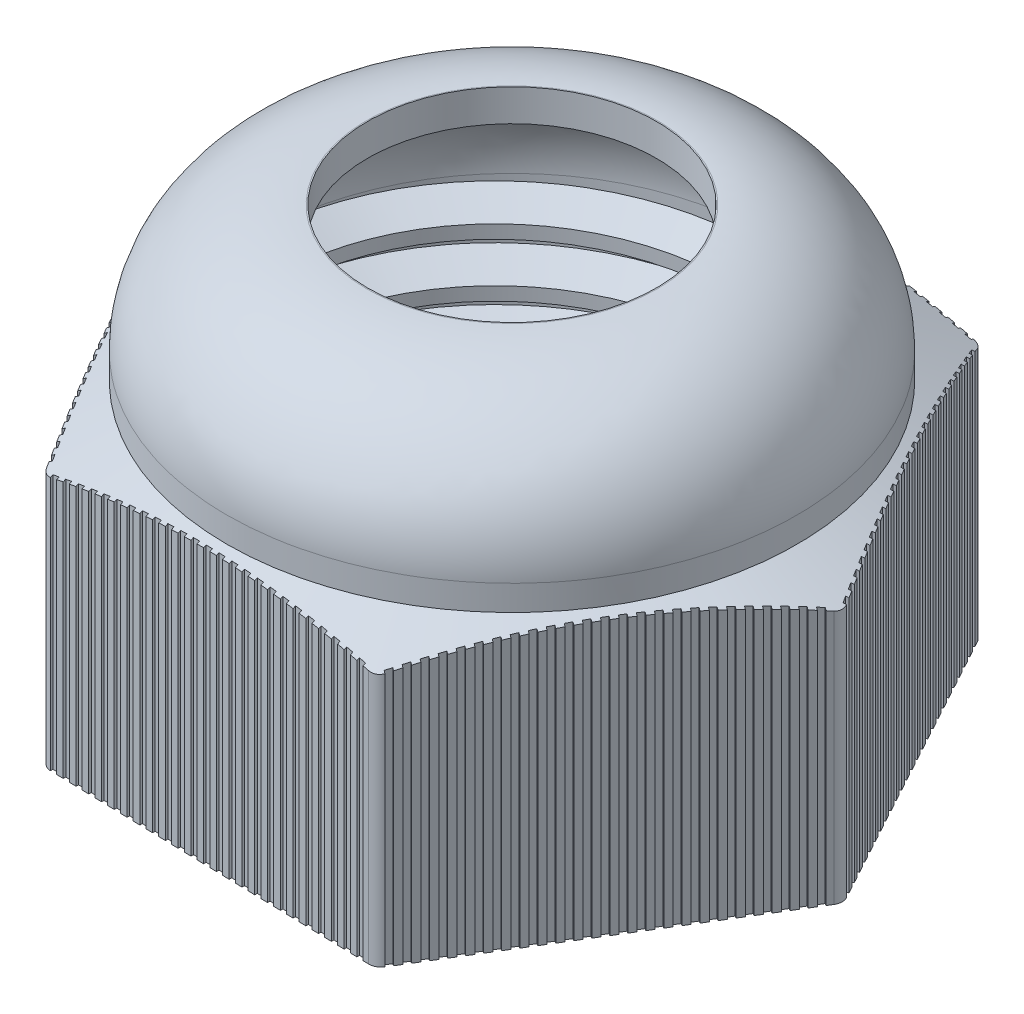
SolidWorks part; units mm, degrees
ref_plane "前视基准面" through (0, 0, 0) normal (0, 0, 1) x (1, 0, 0)
ref_plane "上视基准面" through (0, 0, 0) normal (0, 1, 0) x (1, 0, 0)
ref_plane "右视基准面" through (0, 0, 0) normal (1, 0, 0) x (0, 0, -1)
sketch "草图1" plane through (0, 0, 0) normal (0, 1, 0) x (1, 0, 0)
  line L1 (7.0192, 11.4758) -> (-6.4288, 11.8167)
  line L2 (-6.4288, 11.8167) -> (-13.4479, 0.3409)
  line L3 (-13.4479, 0.3409) -> (-7.0192, -11.4758)
  line L4 (-7.0192, -11.4758) -> (6.4288, -11.8167)
  line L5 (6.4288, -11.8167) -> (13.4479, -0.3409)
  line L6 (13.4479, -0.3409) -> (7.0192, 11.4758)
  circle A0 centre (0, 0) radius 11.65 construction
  dimension "D1" = 23.3
extrude "凸台-拉伸1" add sketch "草图1" along normal blind 11
sketch "草图2" plane through (0, 11, 0) normal (0, 1, 0) x (1, 0, 0)
  circle A0 centre (0, 0) radius 10
extrude "切除-拉伸1" cut sketch "草图2" against normal blind 11
thread "螺纹线1" pitch 2.1167 start angle 0, offset 0, length 9.2, pitch 2.1167, diameter 20
ref_plane "基准面1" through (-10, 11, 0) normal (0, 0, 1) x (-1, 0, 0)
sketch "螺纹线轮廓1" plane through (-10, 11, 0) normal (0, 0, 1) x (-1, 0, 0)
  line L0 (0, 0) -> (0, 2.1167) construction
  line L11 (0, 0) -> (0, 1.8521)
  line L12 (0, 1.8521) -> (-1.1457, 1.1906)
  line L13 (-1.1457, 1.1906) -> (-1.1457, 0.6615)
  line L15 (-1.1457, 0.6615) -> (0, 0)
  line L17 (-1.1457, 0.926) -> (0, 0.926) construction
  point P2 (0, 0)
  dimension "Pitch" = 2.1167
  dimension "Profile_Angle" = 60
  dimension "Profile_Land" = 0.5292
  dimension "Profile_Height" = 1.1457
sketch "草图6" plane through (-0.2952, 0, 11.6463) normal (-0.0253, 0, 0.9997) x (0.9997, 0, 0.0253)
  line L1 (-6.2084, 11) -> (-6.2084, 0)
  line L2 (-5.6907, 11) -> (-5.6907, 0)
  line L3 (-5.173, 11) -> (-5.173, 0)
  line L4 (-4.6553, 11) -> (-4.6553, 0)
  line L5 (-4.1375, 11) -> (-4.1375, 0)
  line L6 (-3.6198, 11) -> (-3.6198, 0)
  line L7 (-3.1021, 11) -> (-3.1021, 0)
  line L8 (-2.5844, 11) -> (-2.5844, 0)
  line L9 (-2.0667, 11) -> (-2.0667, 0)
  line L10 (-1.549, 11) -> (-1.549, 0)
  line L11 (-1.0312, 11) -> (-1.0312, 0)
  line L12 (-0.5135, 11) -> (-0.5135, 0)
  line L13 (0.0042, 11) -> (0.0042, 0)
  line L14 (0.5219, 11) -> (0.5219, 0)
  line L15 (1.0396, 11) -> (1.0396, 0)
  line L16 (1.5573, 11) -> (1.5573, 0)
  line L17 (2.0751, 11) -> (2.0751, 0)
  line L18 (2.5928, 11) -> (2.5928, 0)
  line L19 (3.1105, 11) -> (3.1105, 0)
  line L20 (3.6282, 11) -> (3.6282, 0)
  line L21 (4.1459, 11) -> (4.1459, 0)
  line L22 (4.6636, 11) -> (4.6636, 0)
  line L23 (5.1814, 11) -> (5.1814, 0)
  line L24 (5.6991, 11) -> (5.6991, 0)
  line L25 (6.2168, 11) -> (6.2168, 0)
extrude "切除-拉伸-薄壁2" cut sketch "草图6" against normal blind 0.1 thin
pattern_circular "阵列(圆周)1" count 6 over 360 about axis through (0, 0, 0) along (0, 1, 0) of "切除-拉伸-薄壁2"
fillet "圆角2" radius 0.5 1 edges at (-7.0192, 5.5, 11.4758)
fillet "圆角3" radius 0.5 1 edges at (6.4288, 5.5, 11.8167)
fillet "圆角4" radius 0.5 1 edges at (13.4479, 5.5, 0.3409)
fillet "圆角5" radius 0.5 1 edges at (7.0192, 5.5, -11.4758)
fillet "圆角6" radius 0.5 1 edges at (-6.6136, 5.5, -11.3229)
fillet "圆角7" radius 0.5 1 edges at (-6.4288, 5.5, -11.8167)
fillet "圆角8" radius 0.5 1 edges at (-13.4479, 5.5, -0.3409)
sketch "草图7" plane through (0, 11, 0) normal (0, 1, 0) x (1, 0, 0)
  circle A0 centre (0, 0) radius 11.25
extrude "切除-拉伸3" cut sketch "草图7" against normal blind 1 draft 65 flip side to cut
sketch "草图8" plane through (0, 11, 0) normal (0, 1, 0) x (1, 0, 0)
  circle A0 centre (0, 0) radius 11.25
extrude "凸台-拉伸2" add sketch "草图8" along normal blind 6
fillet "圆角9" radius 5 1 edges at (0, 17, 11.25)
sketch "草图9" plane through (0, 17, 0) normal (0, 1, 0) x (1, 0, 0)
  circle A0 centre (0, 0) radius 5.704
extrude "切除-拉伸4" cut sketch "草图9" against normal through all
sketch "草图12" plane through (0, 0, 0) normal (1, 0, 0) x (0, 0, -1)
  line L0 (0, 0) -> (0, 17) construction
  line L1 (5.704, 17) -> (-5.704, 17) construction
  line L2 (10, 11) -> (0, 11)
  line L3 (-10, 11) -> (10, 11) construction
  line L4 (-11.25, 11) -> (11.25, 11) construction
  line L5 (-5.704, 11) -> (5.704, 11) construction
  line L6 (0, 11) -> (0, 15.7367)
  line L7 (6.601, 15.7367) -> (0, 15.7367)
  arc A0 (10, 11) -> (6.601, 15.7367) centre (5, 11) ccw
revolve "切除-旋转5" cut sketch "草图12" angle 360 about L0
